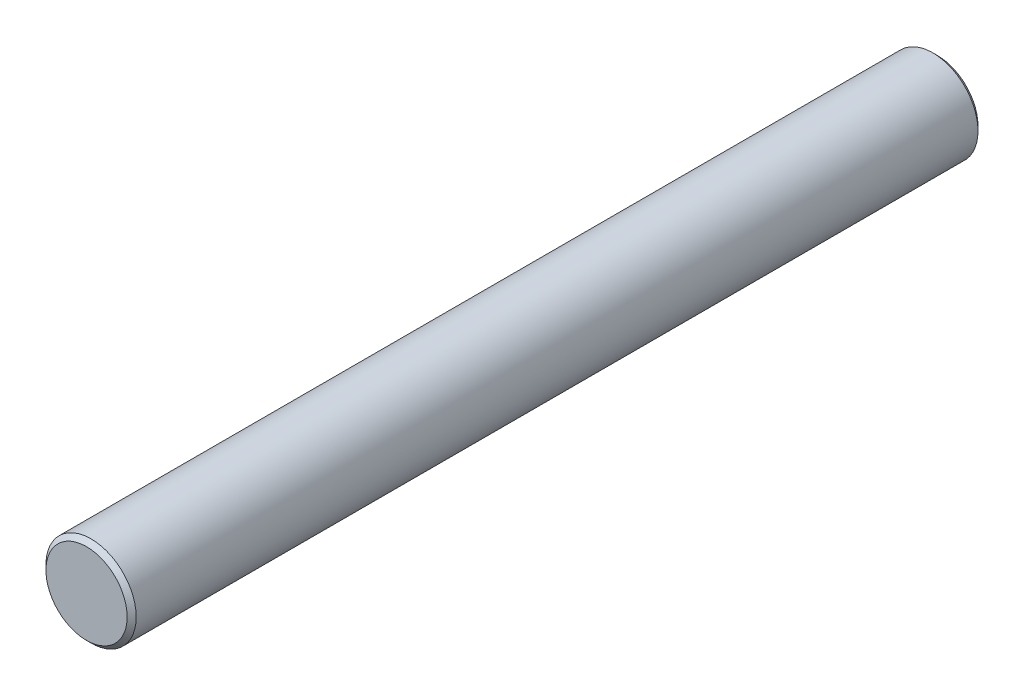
SolidWorks part; units mm, degrees
ref_plane "Plan de face" through (0, 0, 0) normal (0, 0, 1) x (1, 0, 0)
ref_plane "Plan de dessus" through (0, 0, 0) normal (0, 1, 0) x (1, 0, 0)
ref_plane "Plan de droite" through (0, 0, 0) normal (1, 0, 0) x (0, 0, -1)
sketch "Esquisse1" plane through (0, 0, 0) normal (0, 1, 0) x (1, 0, 0)
  line L0 (7, 88.5) -> (0, 84.294)
  line L1 (0, 84.294) -> (0, -238.706)
  line L2 (0, -238.706) -> (18, -238.706)
  line L3 (18, -238.706) -> (20, -236.706)
  line L4 (20, -236.706) -> (20, 136.294)
  line L5 (20, 136.294) -> (18, 138.294)
  line L6 (18, 138.294) -> (7, 138.294)
  line L7 (7, 138.294) -> (7, 88.5)
  line L8 (0, 138.5) -> (0, -138.5) construction
  dimension "D1" = 20
  dimension "D2" = 2
  dimension "D3" = 377
  dimension "D4" = 14
  dimension "D5" = 84.294
  dimension "D6" = 2
  dimension "D7" = 2
  dimension "D8" = 2
  dimension "D9" = 4.206
  dimension "D10" = 54
revolve "Révolution1" add sketch "Esquisse1" angle 360 about L8
